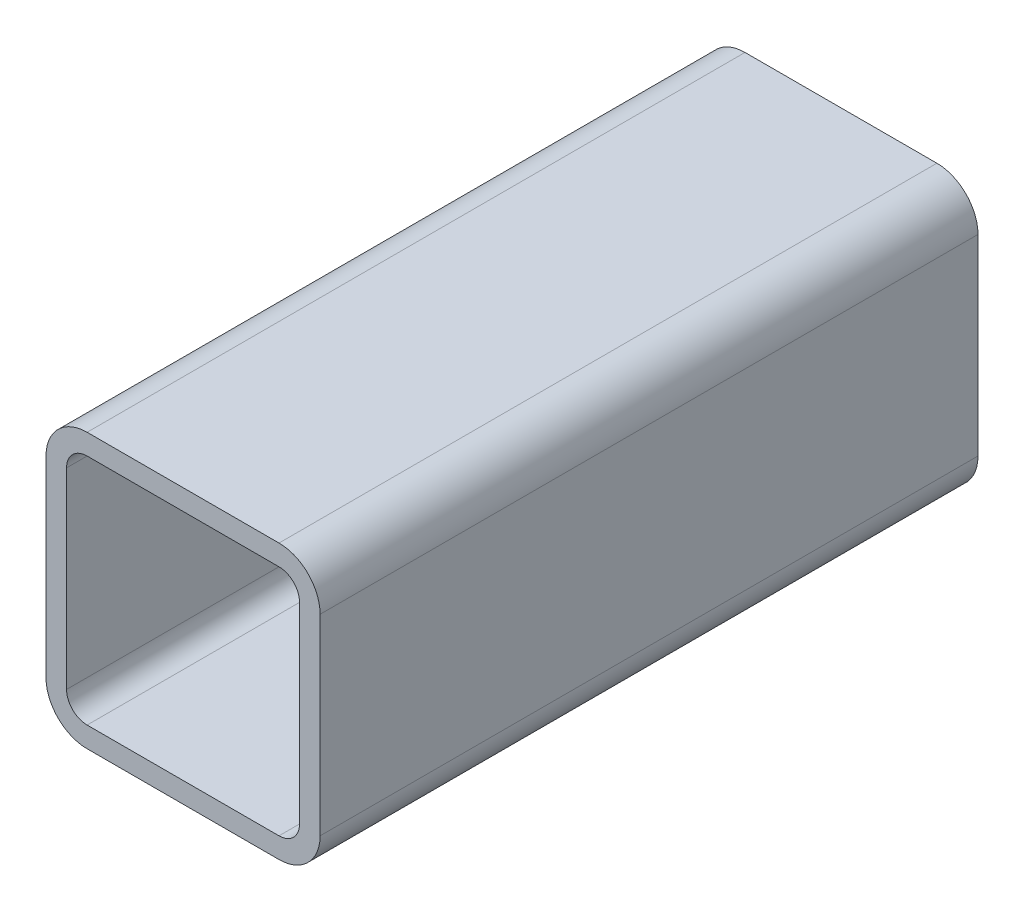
SolidWorks part; units mm, degrees
ref_plane "Front Plane" through (0, 0, 0) normal (0, 0, 1) x (1, 0, 0)
ref_plane "Top Plane" through (0, 0, 0) normal (0, 1, 0) x (1, 0, 0)
ref_plane "Right Plane" through (0, 0, 0) normal (1, 0, 0) x (0, 0, -1)
sketch "Sketch1" plane through (0, 0, 0) normal (0, 0, 1) x (1, 0, 0)
sketch_block_instance "HSS5x5x0.375-1"
sketch_block "HSS5x5x0.375"
extrude "Boss-Extrude1" add sketch "Sketch1" along normal blind 304.8
